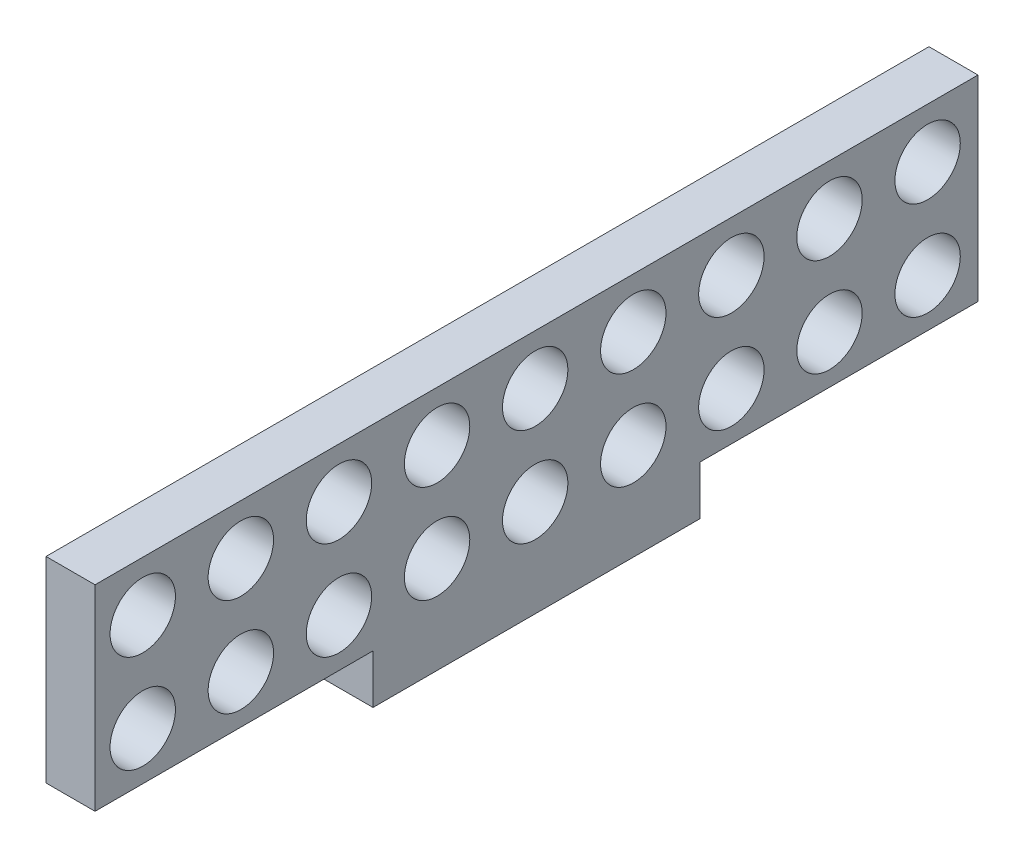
SolidWorks part; units mm, degrees
ref_plane "Front Plane" through (0, 0, 0) normal (0, 0, 1) x (1, 0, 0)
ref_plane "Top Plane" through (0, 0, 0) normal (0, 1, 0) x (1, 0, 0)
ref_plane "Right Plane" through (0, 0, 0) normal (1, 0, 0) x (0, 0, -1)
sketch "Sketch1" plane through (0, 0, 0) normal (1, 0, 0) x (0, 0, -1)
  line L0 (-32.396, -4.0569) -> (-49.396, -4.0569)
  line L1 (-49.396, -7.0569) -> (-69.396, -7.0569)
  line L2 (-32.396, -4.0569) -> (-32.396, 7.9431)
  line L3 (-32.396, 7.9431) -> (-86.396, 7.9431)
  line L4 (-86.396, -4.0569) -> (-86.396, 7.9431)
  line L5 (-69.396, -4.0569) -> (-86.396, -4.0569)
  line L6 (-35.4787, -1.1236) -> (-41.4787, -1.1236) construction
  line L8 (-69.396, -7.0569) -> (-69.396, -4.0569)
  line L9 (-49.396, -7.0569) -> (-49.396, -4.0569)
  circle A0 centre (-35.4787, -1.1236) radius 2
  circle A1 centre (-41.4787, -1.1236) radius 2
  circle A2 centre (-47.4787, -1.1236) radius 2
  circle A3 centre (-53.4787, -1.1236) radius 2
  circle A4 centre (-59.4787, -1.1236) radius 2
  circle A5 centre (-65.4787, -1.1236) radius 2
  circle A6 centre (-71.4787, -1.1236) radius 2
  circle A7 centre (-77.4787, -1.1236) radius 2
  circle A8 centre (-83.4787, -1.1236) radius 2
  circle A9 centre (-35.4787, 4.8764) radius 2
  circle A10 centre (-41.4787, 4.8764) radius 2
  circle A11 centre (-47.4787, 4.8764) radius 2
  circle A12 centre (-53.4787, 4.8764) radius 2
  circle A13 centre (-59.4787, 4.8764) radius 2
  circle A14 centre (-65.4787, 4.8764) radius 2
  circle A15 centre (-71.4787, 4.8764) radius 2
  circle A16 centre (-77.4787, 4.8764) radius 2
  circle A17 centre (-83.4787, 4.8764) radius 2
  dimension "D3" = 2
extrude "Boss-Extrude1" add sketch "Sketch1" along normal blind 3
